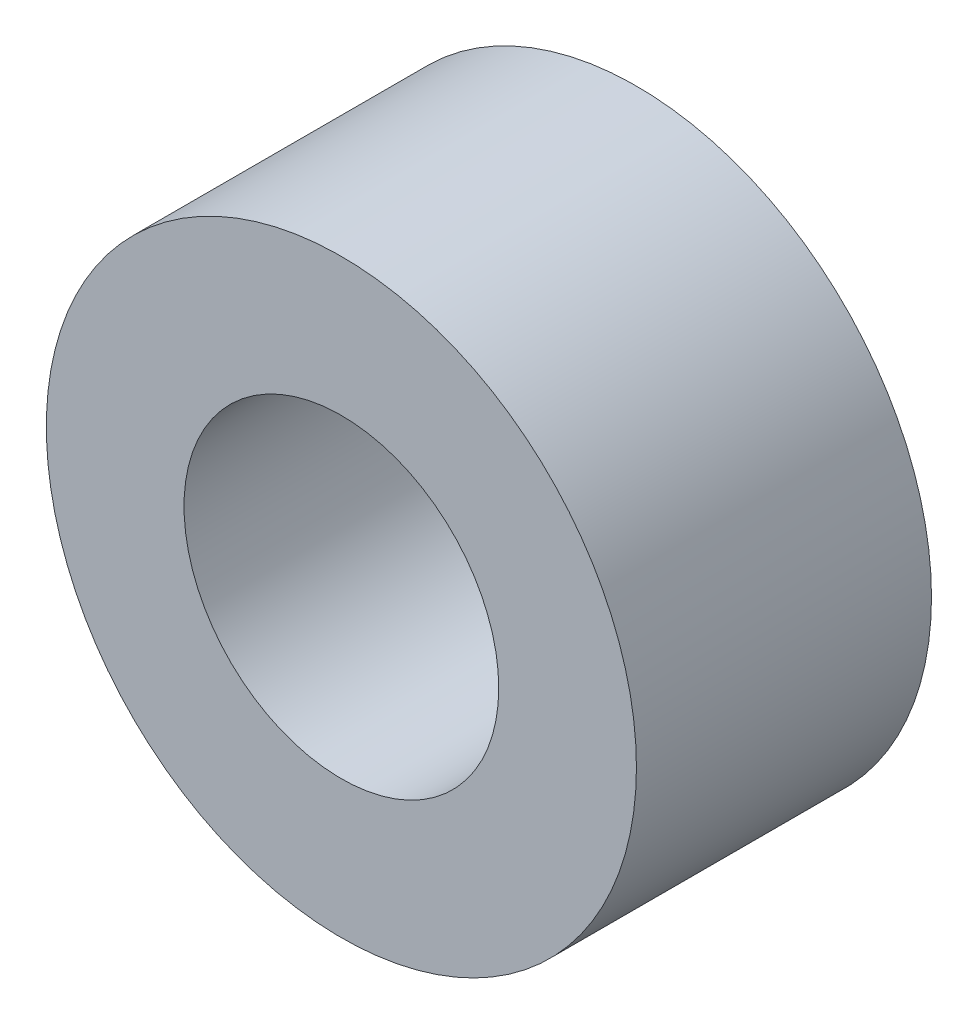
SolidWorks part; units mm, degrees
ref_plane "Alzado" through (0, 0, 0) normal (0, 0, 1) x (1, 0, 0)
ref_plane "Planta" through (0, 0, 0) normal (0, 1, 0) x (1, 0, 0)
ref_plane "Vista lateral" through (0, 0, 0) normal (1, 0, 0) x (0, 0, -1)
sketch "Croquis1" plane through (0, 0, 0) normal (0, 0, 1) x (1, 0, 0)
  circle A0 centre (0, 0) radius 4
  circle A1 centre (0, 0) radius 7.5
  dimension "D1" = 15
  dimension "D2" = 8
extrude "Saliente-Extruir1" add sketch "Croquis1" along normal mid plane 7.5
